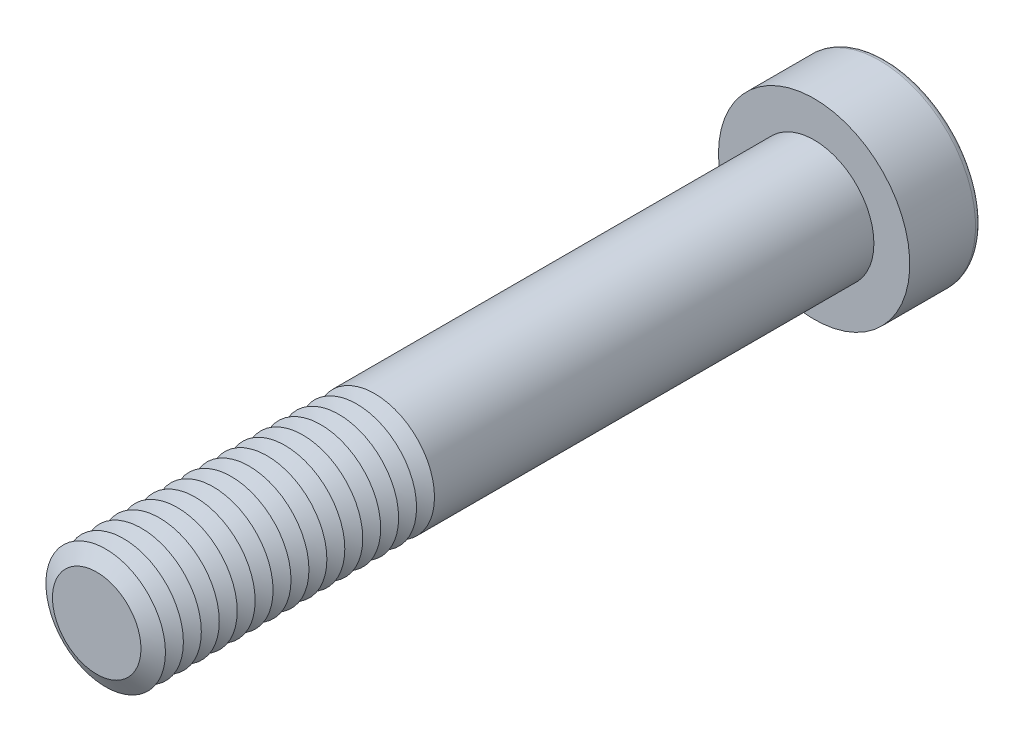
SolidWorks part; units mm, degrees
ref_plane "Front Plane" through (0, 0, 0) normal (0, 0, 1) x (1, 0, 0)
ref_plane "Top Plane" through (0, 0, 0) normal (0, 1, 0) x (1, 0, 0)
ref_plane "Right Plane" through (0, 0, 0) normal (1, 0, 0) x (0, 0, -1)
sketch "Sketch1" plane through (0, 0, 0) normal (0, 0, 1) x (1, 0, 0)
  circle A0 centre (0, 0) radius 5
  dimension "D1" = 10
extrude "Boss-Extrude1" add sketch "Sketch1" along normal blind 60
sketch "Sketch2" plane through (0, 0, 0) normal (0, 0, -1) x (-1, 0, 0)
  circle A0 centre (0, 0) radius 8
  dimension "D1" = 16
extrude "Boss-Extrude2" add sketch "Sketch2" along normal blind 6
sketch "Sketch3" plane through (0, 0, -6) normal (0, 0, -1) x (-1, 0, 0)
  line L1 (-2.0207, 3.5) -> (-4.0415, 0)
  line L2 (-4.0415, 0) -> (-2.0207, -3.5)
  line L3 (-2.0207, -3.5) -> (2.0207, -3.5)
  line L4 (2.0207, -3.5) -> (4.0415, 0)
  line L5 (4.0415, 0) -> (2.0207, 3.5)
  line L6 (2.0207, 3.5) -> (-2.0207, 3.5)
  circle A0 centre (0, 0) radius 3.5 construction
  dimension "D1" = 7
extrude "Cut-Extrude1" cut sketch "Sketch3" against normal blind 5.25
fillet "Fillet1" radius 0.5 1 edges at (-8, 0, -6)
sketch "Sketch4" plane through (0, 0, -0.75) normal (0, 0, -1) x (-1, 0, 0)
  line L0 (2.0207, -3.5) -> (4.0415, 0) construction
  circle A0 centre (0, 0) radius 3.5
extrude "Cut-Extrude2" cut sketch "Sketch4" against normal through all draft 60
sketch "Sketch5" plane through (0, 0, -6) normal (0, 0, -1) x (-1, 0, 0)
  circle A0 centre (0, 0) radius 4.0415
extrude "Cut-Extrude3" cut sketch "Sketch5" against normal through all draft 75
sketch "Sketch7" plane through (0, 0, 0) normal (1, 0, 0) x (0, 0, -1)
  line L25 (-60, 3.701) -> (-59.25, 5)
  line L26 (-60, 5) -> (-60, -5) construction
  line L27 (-59.25, 5) -> (-60.75, 5)
  line L28 (-60.75, 5) -> (-60, 3.701)
  line L29 (0, 5) -> (-60, 5) construction
  dimension "D1" = 1.5
revolve "Cut-Revolve1" cut sketch "Sketch7" angle 360 about axis through (0, 0, 60) along (0, 0, -1)
pattern_linear "LPattern1" count 16 spacing 1.5 along (0, 0, -1) of "Cut-Revolve1"
